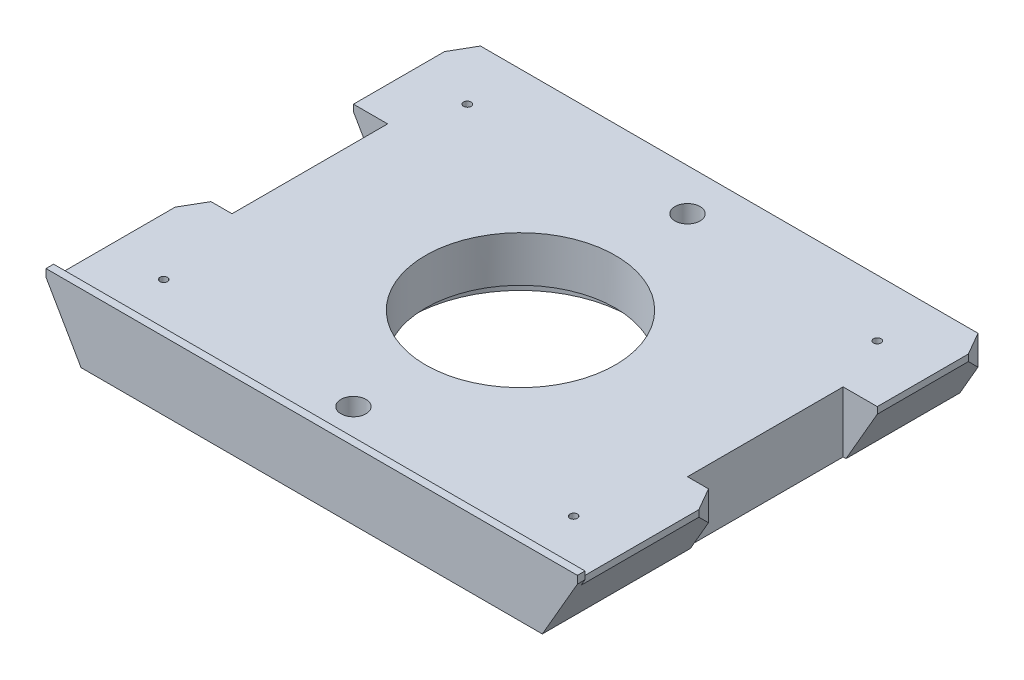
SolidWorks part; units mm, degrees
ref_plane "Front Plane" through (0, 0, 0) normal (0, 0, 1) x (1, 0, 0)
ref_plane "Top Plane" through (0, 0, 0) normal (0, 1, 0) x (1, 0, 0)
ref_plane "Right Plane" through (0, 0, 0) normal (1, 0, 0) x (0, 0, -1)
sketch "Sketch1" plane through (0, 0, 0) normal (1, 0, 0) x (0, 0, -1)
  line L1 (-27.5, -4) -> (27.5, -4)
  line L2 (-27.5, -4) -> (-27.5, 4)
  line L3 (-27.5, 4) -> (27.5, 4)
  line L4 (27.5, -4) -> (27.5, 4)
  line L5 (-27.5, -4) -> (27.5, 4) construction
  line L6 (-27.5, 4) -> (27.5, -4) construction
  point P0 (0, 0)
  dimension "D1" = 8
  dimension "D2" = 55
extrude "Boss-Extrude1" add sketch "Sketch1" along normal mid plane 70
sketch "Sketch2" plane through (0, 0, 27.5) normal (0, 0, 1) x (1, 0, 0)
  line L0 (-35, 4) -> (-30.3812, -4)
  line L1 (35, -4) -> (-35, -4) construction
  line L2 (-30.3812, -4) -> (-35, -4)
  line L3 (-35, -4) -> (-35, 4)
  line L4 (35, 4) -> (35, -4)
  line L5 (35, -4) -> (30.3812, -4)
  line L6 (30.3812, -4) -> (35, 4)
  dimension "D1" = 60
  dimension "D2" = 60
extrude "Cut-Extrude1" cut sketch "Sketch2" against normal through all
sketch "Sketch20" plane through (0, 4, 0) normal (0, 1, 0) x (1, 0, 0)
  line L0 (35, 27.5) -> (35, -27.5) construction
  line L1 (-35, -27.5) -> (35, -27.5)
  line L2 (-35, -27.5) -> (-35, -26.5)
  line L3 (-35, -26.5) -> (35, -26.5)
  line L4 (35, -27.5) -> (35, -26.5)
  dimension "D1" = 1
extrude "Boss-Extrude2" add sketch "Sketch20" along normal blind 1
sketch "Sketch23" plane through (0, 0, 26.5) normal (0, 0, -1) x (-1, 0, 0)
  line L0 (-35, 4) -> (-34.5, 4)
  line L1 (-35, 4) -> (35, 4) construction
  line L2 (-34.5, 4) -> (-34.5, 3.134)
  line L3 (-35, 4) -> (-30.3812, -4) construction
  line L4 (-34.5, 3.134) -> (-35, 4)
  line L5 (35, 4) -> (34.5, 4)
  line L6 (-35, 4) -> (35, 4) construction
  line L7 (34.5, 4) -> (34.5, 3.134)
  line L8 (30.3812, -4) -> (35, 4) construction
  line L9 (34.5, 3.134) -> (35, 4)
  dimension "D1" = 0.5
  dimension "D2" = 0.5
extrude "Cut-Extrude4" cut sketch "Sketch23" along normal up to surface (54 mm away)
hole_wizard "Ø1.0 (1) Diameter Hole1" positions "Sketch25" profile "Sketch24" hole size "Ø1.0" standard "ANSI Metric"
sketch "Sketch25" plane through (0, 4, 0) normal (0, 1, 0) x (1, 0, 0)
  line L0 (-34.5, 20) -> (-27, 20) construction
  line L1 (-34.5, 27.5) -> (-34.5, -26.5) construction
  line L2 (-27, 20) -> (27, 20) construction
  line L3 (27, 20) -> (34.5, 20) construction
  line L4 (34.5, 27.5) -> (34.5, -26.5) construction
  line L8 (27, 20) -> (27, -20) construction
  line L10 (27, -20) -> (-27, -20) construction
  line L11 (-27, -20) -> (-27, 20) construction
  point P0 (-27, 20)
  point P2 (27, 20)
  point P4 (27, -20)
  point P6 (-27, -20)
  dimension "D1" = 40
  dimension "D2" = 54
  dimension "D3" = 20
sketch "Sketch24" plane through (-27, 4, -20) normal (1, 0, 0) x (0, 0, 1)
  line L0 (0, 0) -> (0, 2.3004)
  line L1 (0, 2.3004) -> (0.5, 2)
  line L2 (0.5, 2) -> (0.5, 0)
  line L5 (0.5, 0) -> (0, 0)
  line L10 (0, 2.3004) -> (-0.5, 2) construction
  line L11 (0, -6.35) -> (0, 107.95) construction
  dimension "Hole Dia." = 1
  dimension "Hole Depth" = 2
  dimension "Drill Angle" = 118
sketch "Sketch26" plane through (0, 4, 0) normal (0, 1, 0) x (1, 0, 0)
  line L0 (-34.5, 27.5) -> (-34.5, -26.5) construction
  line L1 (-34.5, 12.5) -> (-30, 12.5)
  line L2 (-34.5, 12.5) -> (-34.5, -8)
  line L3 (-34.5, -8) -> (-30, -8)
  line L4 (-30, 12.5) -> (-30, -8)
  line L5 (34.5, 27.5) -> (34.5, -26.5) construction
  line L6 (34.5, 12.5) -> (30, 12.5)
  line L7 (34.5, 12.5) -> (34.5, -8)
  line L8 (34.5, -8) -> (30, -8)
  line L9 (30, 12.5) -> (30, -8)
  line L10 (34.5, 27.5) -> (-34.5, 27.5) construction
  dimension "D1" = 15
  dimension "D2" = 20.5
  dimension "D3" = 4.5
extrude "Cut-Extrude5" cut sketch "Sketch26" against normal through all
sketch "Sketch27" plane through (0, 4, 0) normal (0, 1, 0) x (1, 0, 0)
  circle A0 centre (0, 0) radius 12.5
  dimension "D1" = 25
extrude "Cut-Extrude6" cut sketch "Sketch27" against normal through all
sketch "Sketch29" plane through (0, -4, 0) normal (0, -1, 0) x (-1, 0, 0)
  circle A0 centre (0, 0) radius 14.5
  dimension "D1" = 29
extrude "Cut-Extrude7" cut sketch "Sketch29" against normal blind 2
hole_wizard "M4x0.7 Tapped Hole1" positions "Sketch31" profile "Sketch30" tap size "M4x0.7" standard "ANSI Metric"
sketch "Sketch31" plane through (0, 4, 0) normal (0, 1, 0) x (1, 0, 0)
  line L0 (0, 22) -> (0, 0) construction
  line L1 (0, 0) -> (0, -22) construction
  point P0 (0, 22)
  point P2 (0, -22)
  dimension "D1" = 22
sketch "Sketch30" plane through (0, 4, -22) normal (1, 0, 0) x (0, 0, 1)
  line L0 (0, 0) -> (0, 8)
  line L1 (0, 8) -> (1.65, 8)
  line L2 (1.65, 8) -> (1.65, 0)
  line L5 (1.65, 0) -> (0, 0)
  line L11 (0, -6.35) -> (0, 107.95) construction
  dimension "Thru Tap Drill Dia." = 3.3
  dimension "Thru Tap Drill Depth" = 8
chamfer "Chamfer1" [suppressed] distance 0.5 angle 45
sketch "Sketch33" plane through (0, 4, 0) normal (0, 1, 0) x (1, 0, 0)
  line L0 (-34.5, 27.5) -> (-34.5, 24.5)
  line L1 (-34.5, 27.5) -> (-34.5, 12.5) construction
  line L3 (-34.5, 24.5) -> (-32.7679, 27.5)
  line L4 (-34.5, -8) -> (-32.7679, -8)
  line L5 (-34.5, -8) -> (-30, -8) construction
  line L6 (-32.7679, -8) -> (-34.5, -11)
  line L7 (-34.5, -8) -> (-34.5, -26.5) construction
  line L8 (-34.5, -11) -> (-34.5, -8)
  line L9 (34.5, 27.5) -> (32.7679, 27.5)
  line L10 (34.5, 27.5) -> (-34.5, 27.5) construction
  line L11 (32.7679, 27.5) -> (34.5, 24.5)
  line L12 (34.5, 24.5) -> (34.5, 27.5)
  line L13 (34.5, -8) -> (32.7679, -8)
  line L14 (30, -8) -> (34.5, -8) construction
  line L15 (32.7679, -8) -> (34.5, -11)
  line L16 (34.5, -8) -> (34.5, -26.5) construction
  line L17 (34.5, -11) -> (34.5, -8)
  line L18 (-32.7679, 27.5) -> (-34.5, 27.5)
  dimension "D1" = 3
  dimension "D2" = 30
  dimension "D3" = 30
  dimension "D4" = 30
  dimension "D5" = 3
  dimension "D6" = 30
  dimension "D7" = 3
extrude "Cut-Extrude8" cut sketch "Sketch33" against normal through all
